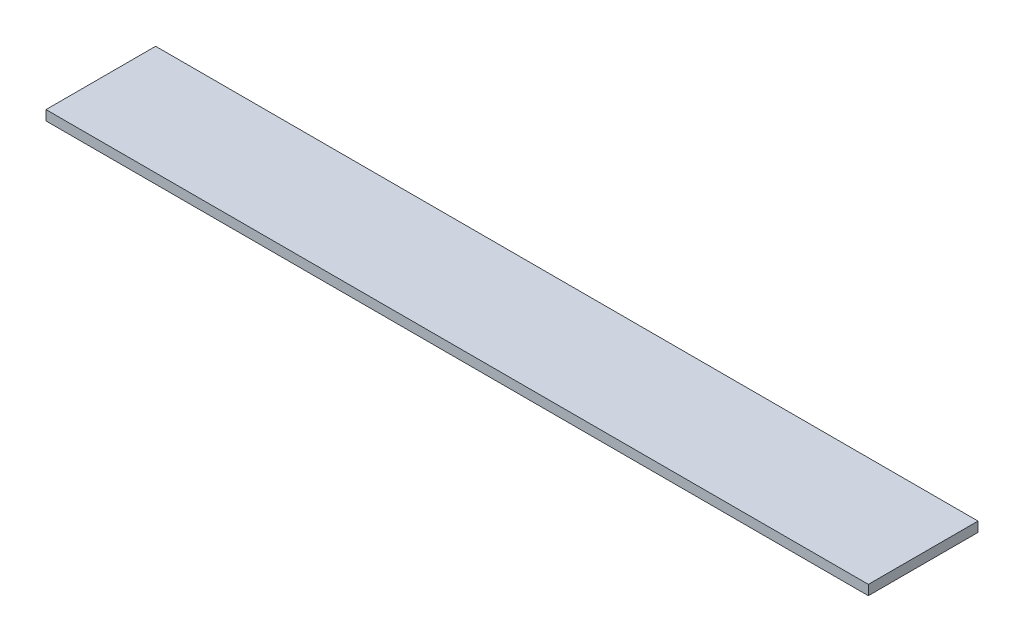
SolidWorks part; units mm, degrees
ref_plane "Plan de face" through (0, 0, 0) normal (0, 0, 1) x (1, 0, 0)
ref_plane "Plan de dessus" through (0, 0, 0) normal (0, 1, 0) x (1, 0, 0)
ref_plane "Plan de droite" through (0, 0, 0) normal (1, 0, 0) x (0, 0, -1)
sketch "Esquisse1" plane through (0, 0, 0) normal (0, 1, 0) x (1, 0, 0)
  line L1 (-750, -100) -> (750, -100)
  line L2 (-750, -100) -> (-750, 100)
  line L3 (-750, 100) -> (750, 100)
  line L4 (750, -100) -> (750, 100)
  line L5 (-750, -100) -> (750, 100) construction
  line L6 (-750, 100) -> (750, -100) construction
  point P0 (0, 0)
  dimension "D1" = 1500
  dimension "D2" = 200
extrude "Boss.-Extru.1" add sketch "Esquisse1" along normal blind 18
